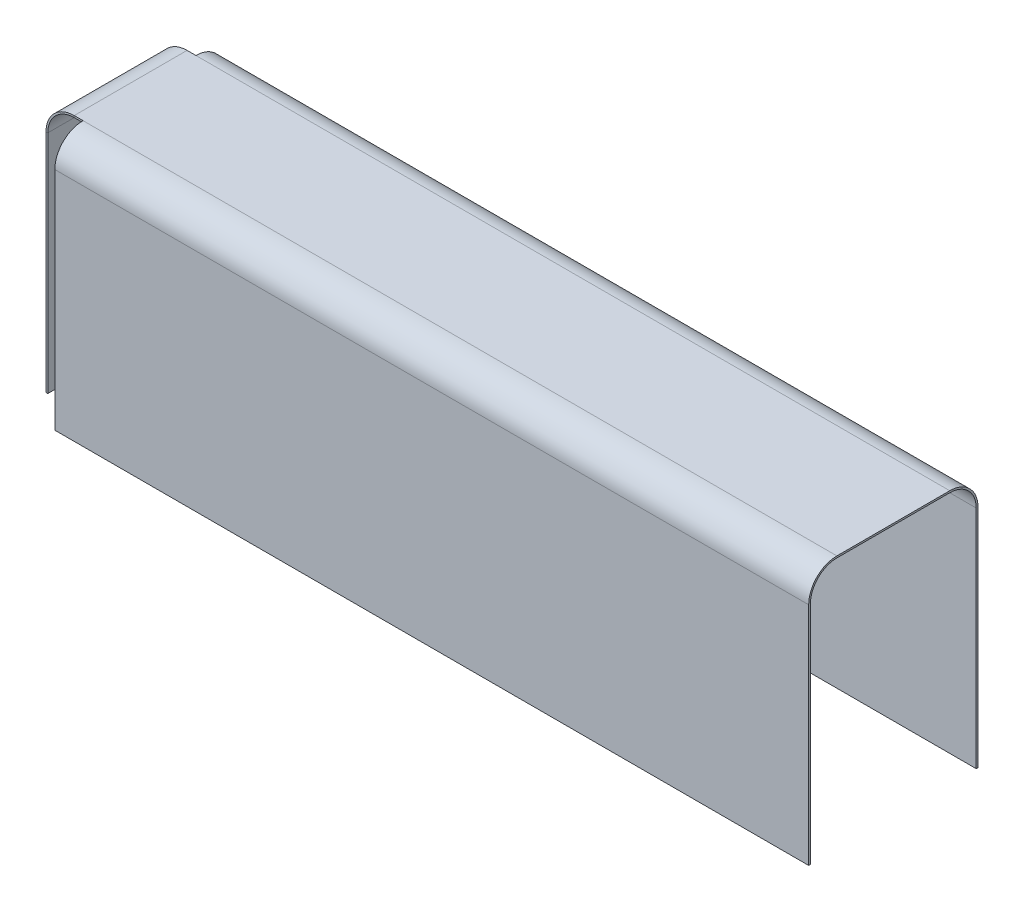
SolidWorks part; units mm, degrees
ref_plane "Front Plane" through (0, 0, 0) normal (0, 0, 1) x (1, 0, 0)
ref_plane "Top Plane" through (0, 0, 0) normal (0, 1, 0) x (1, 0, 0)
ref_plane "Right Plane" through (0, 0, 0) normal (1, 0, 0) x (0, 0, -1)
sketch "Sketch1" plane through (0, 0, 0) normal (0, 1, 0) x (1, 0, 0)
  line L1 (-169.6307, -38.1) -> (169.6307, -38.1)
  line L2 (-169.6307, -38.1) -> (-169.6307, 38.1)
  line L3 (-169.6307, 38.1) -> (169.6307, 38.1)
  line L4 (169.6307, -38.1) -> (169.6307, 38.1)
  point P4 (-169.6307, 0)
  point P5 (0, 38.1)
  dimension "D1" = 339.2614
  dimension "D2" = 76.2
extrude "Boss-Extrude1" add sketch "Sketch1" along normal blind 114.3
fillet "Fillet1" radius 12.7 2 edges at (0, 114.3, -38.1) (0, 114.3, 38.1)
shell "Shell1" thickness 0.7937
sketch "Sketch2" plane through (-169.6307, 0, 0) normal (-1, 0, 0) x (0, 0, 1)
  line L0 (-25.4, 114.3) -> (25.4, 114.3) construction
  line L1 (-25.4, 114.3) -> (25.4, 114.3)
  line L2 (-25.4, 114.3) -> (-25.4, 113.5063)
  line L3 (-25.4, 113.5063) -> (25.4, 113.5063)
  line L4 (25.4, 114.3) -> (25.4, 113.5063)
  line L5 (-25.4, 113.5063) -> (25.4, 113.5063) construction
  point P4 (25.4, 114.3)
  point P5 (-25.4, 114.3)
sketch "Sketch3" plane through (0, 0, 0) normal (0, 0, 1) x (1, 0, 0)
  line L0 (-186.2995, 0) -> (-186.2995, 101.6)
  line L1 (-169.6307, 0) -> (169.6307, 0) construction
  line L2 (-169.6307, 101.6) -> (-169.6307, 0) construction
  line L3 (-169.6307, 114.3) -> (-173.5995, 114.3)
  arc A0 (-173.5995, 114.3) -> (-186.2995, 101.6) centre (-173.5995, 101.6) ccw
  dimension "D2" = 12.7
  dimension "D1" = 16.6687
sweep "Sweep1" add profiles "Sketch2" path "Sketch3"
sketch "Sketch4" plane through (-186.2995, 0, 0) normal (-1, 0, 0) x (0, 0, 1)
  line L0 (0, -55) -> (0, 55) construction
  line L1 (25.4, 0) -> (-25.4, 0) construction
  circle A0 centre (0, 22.5425) radius 2.54
  dimension "D2" = 5.08
  dimension "D1" = 22.5425
extrude "Cut-Extrude1" cut sketch "Sketch4" against normal blind 2.54
